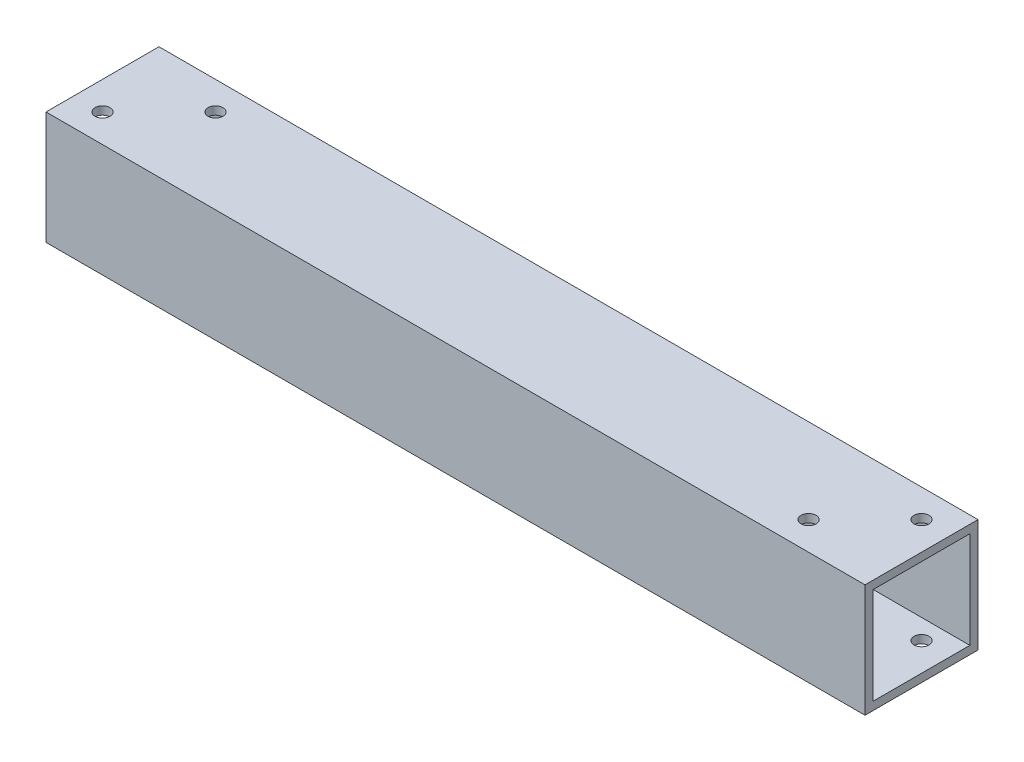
SolidWorks part; units mm, degrees
ref_plane "Front" through (0, 0, 0) normal (0, 0, 1) x (1, 0, 0)
ref_plane "Top" through (0, 0, 0) normal (0, 1, 0) x (1, 0, 0)
ref_plane "Right" through (0, 0, 0) normal (1, 0, 0) x (0, 0, -1)
sketch "Sketch1" plane through (0, 0, 0) normal (1, 0, 0) x (0, 0, -1)
  line L1 (0, 0) -> (50.8, 0)
  line L2 (0, 0) -> (0, 50.8)
  line L3 (0, 50.8) -> (50.8, 50.8)
  line L4 (50.8, 0) -> (50.8, 50.8)
  line L5 (3.6576, 47.1424) -> (47.1424, 47.1424)
  line L6 (3.6576, 47.1424) -> (3.6576, 3.6576)
  line L7 (3.6576, 3.6576) -> (47.1424, 3.6576)
  line L8 (47.1424, 47.1424) -> (47.1424, 3.6576)
  dimension "D1" = 50.8
  dimension "D2" = 50.8
  dimension "D3" = 3.6576
  dimension "D4" = 3.6576
  dimension "D5" = 3.6576
  dimension "D6" = 3.6576
extrude "Extrude1" add sketch "Sketch1" along normal blind 368.3
sketch "Sketch3" plane through (0, 50.8, 0) normal (0, 1, 0) x (1, 0, 0)
  line L0 (0, 50.8) -> (0, 0) construction
  line L1 (0, 25.4) -> (368.3, 25.4) construction
  line L2 (368.3, 50.8) -> (368.3, 0) construction
  circle A0 centre (12.7, 12.7) radius 3.3731
  circle A1 centre (38.1, 38.1) radius 3.3731
  circle A2 centre (355.6, 38.1) radius 3.3731
  circle A3 centre (330.2, 12.7) radius 3.3731
  dimension "D1" = 6.7462
  dimension "D7" = 25.4
  dimension "D8" = 12.7
  dimension "D9" = 12.7
  dimension "D2" = 12.7
  dimension "D3" = 38.1
  dimension "D4" = 12.7
  dimension "D5" = 25.4
  dimension "D6" = 12.7
extrude "Cut-Extrude1" cut sketch "Sketch3" against normal through all
